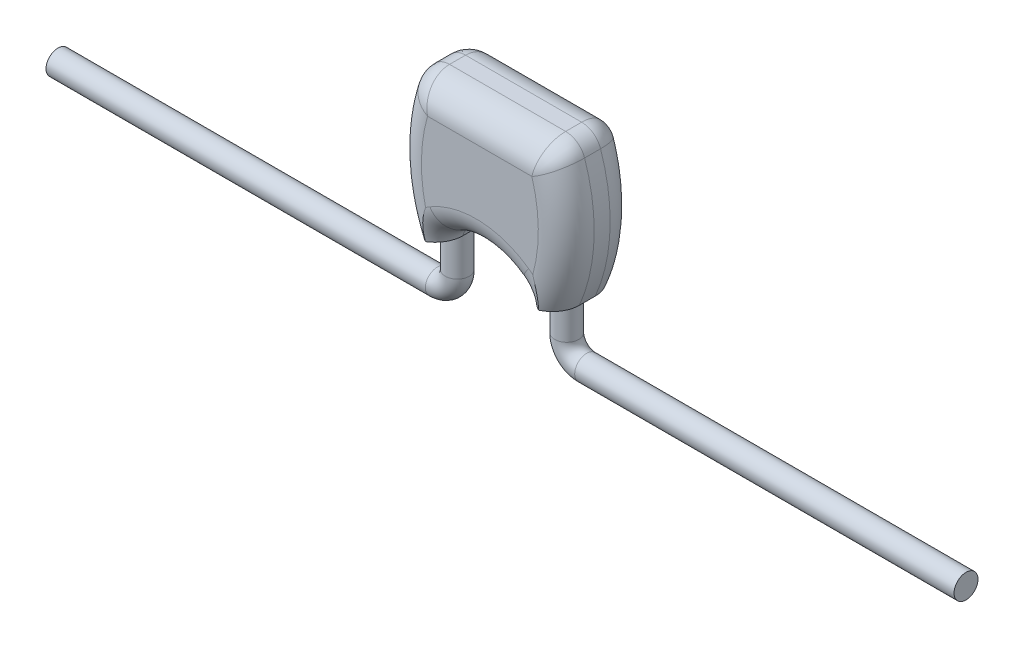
SolidWorks part; units mm, degrees
ref_plane "Face" through (0, 0, 0) normal (0, 0, 1) x (1, 0, 0)
ref_plane "Dessus" through (0, 0, 0) normal (0, 1, 0) x (1, 0, 0)
ref_plane "Droite" through (0, 0, 0) normal (1, 0, 0) x (0, 0, -1)
sketch "Esquisse1" plane through (0, 0, 0) normal (0, 0, 1) x (1, 0, 0)
  line L0 (8.1891, 13.1079) -> (11.0971, 13.1079)
  line L1 (7.2597, 11.3079) -> (12.2165, 11.3079) construction
  line L2 (7.8197, 9.5588) -> (8.5231, 9.5588)
  line L3 (10.6566, 9.5079) -> (11.4402, 9.5079)
  arc A0 (7.7133, 12.7615) -> (7.8197, 9.5588) centre (12.2165, 11.3079) ccw
  arc A1 (11.5706, 12.7683) -> (11.4402, 9.5079) centre (7.2597, 11.3079) cw
  arc A4 (8.753, 9.8706) -> (10.4606, 9.7999) centre (9.5528, 8.5292) cw
  arc A5 (7.7133, 12.7615) -> (8.1891, 13.1079) centre (8.1891, 12.6079) cw
  arc A6 (8.753, 9.8706) -> (8.5231, 9.5588) centre (9.009, 9.4411) ccw
  arc A7 (10.4606, 9.7999) -> (10.6566, 9.5079) centre (10.1699, 9.3931) cw
  arc A8 (11.0971, 13.1079) -> (11.5706, 12.7683) centre (11.0971, 12.6079) cw
  point P13 (7.8402, 13.1079)
  point P20 (11.4402, 13.1079)
  dimension "D2" = 0.5
  dimension "D1" = 3.6
extrude "Extrusion1" add sketch "Esquisse1" along normal blind 1.8
fillet "Congé1" radius 0.7 20 edges at (8.1714, 9.5588, 0) (8.6066, 9.7379, 0) (9.6173, 10.0896, 0) (10.5851, 9.6717, 0) (11.0484, 9.5079, 0) (11.8076, 11.126, 0) (11.3884, 13.0142, 0) (9.6431, 13.1079, 0) (7.8948, 13.0121, 0) (7.4871, 11.1509, 0) (7.8948, 13.0121, 1.8) (9.6431, 13.1079, 1.8) (11.3884, 13.0142, 1.8) (11.8076, 11.126, 1.8) (11.0484, 9.5079, 1.8) (10.5851, 9.6717, 1.8) (9.6173, 10.0896, 1.8) (8.6066, 9.7379, 1.8) (8.1714, 9.5588, 1.8) (7.4871, 11.1509, 1.8)
sketch "Esquisse6" plane through (0, 9.5588, 0) normal (0, -1, 0) x (1, 0, 0)
  line L0 (7.2499, 0.9) -> (10.5402, 0.9) construction
  line L1 (8.1824, 1.5727) -> (8.1824, -0.3327) construction
  circle A0 centre (8.1824, 0.9) radius 0.3
ref_plane "Plan1" through (0, 0, 0.9) normal (0, 0, 1) x (1, 0, 0)
sketch "Esquisse7" plane through (0, 0, 0.9) normal (0, 0, 1) x (1, 0, 0)
  line L0 (-2.6198, 8.0588) -> (10.792, 8.0588) construction
  line L1 (8.1824, 7.8298) -> (8.1824, 11.4737) construction
  line L2 (-1.8176, 9.8672) -> (-1.8176, 7.3988) construction
  line L3 (7.2499, 9.5588) -> (10.5402, 9.5588) construction
  line L4 (8.1824, 9.5588) -> (8.1824, 8.5588)
  line L5 (7.6824, 8.0588) -> (-1.8176, 8.0588)
  arc A0 (8.1824, 8.5588) -> (7.6824, 8.0588) centre (7.6824, 8.5588) cw
  point P14 (8.1824, 8.0588)
  dimension "D3" = 0.5
  dimension "D1" = 1.5
  dimension "D2" = 10
sweep "Balayage1" add profiles "Esquisse6" path "Esquisse7"
ref_plane "Plan2" through (9.5528, 0, 0) normal (1, 0, 0) x (0, 0, -1)
mirror "Symétrie1" about plane through (9.5528, 0, 0) normal (1, 0, 0) of "Balayage1"
